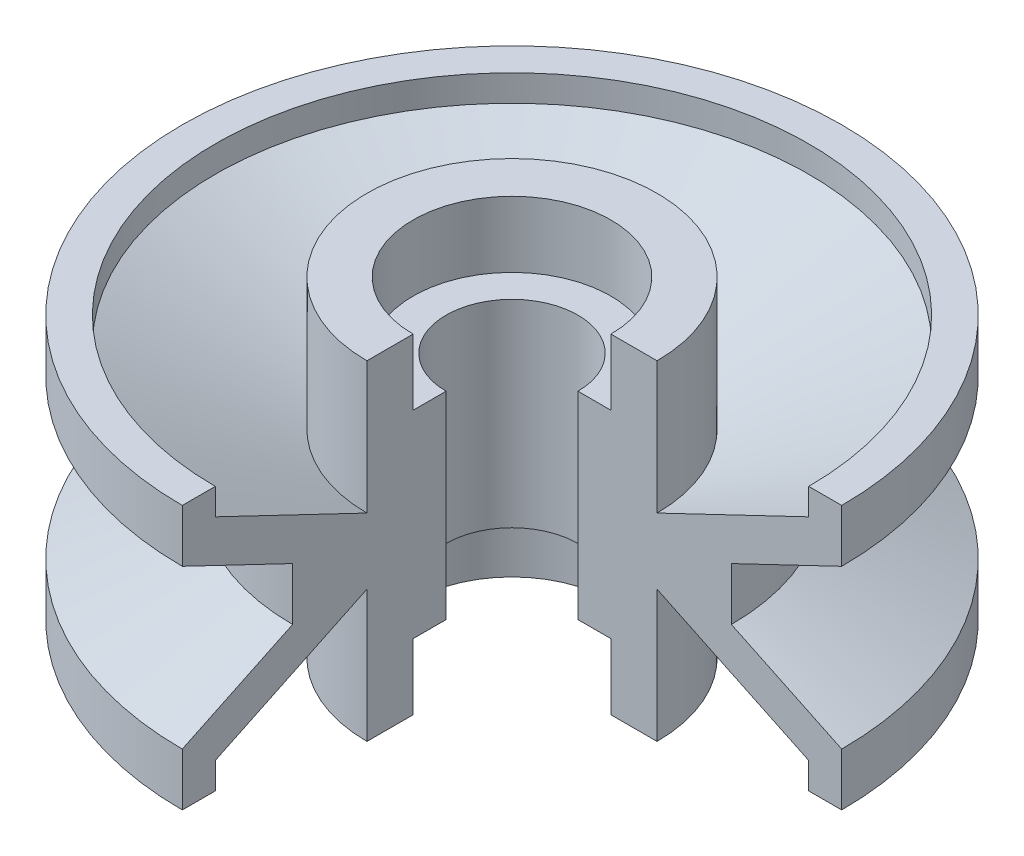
SolidWorks part; units mm, degrees
ref_plane "Front Plane" through (0, 0, 0) normal (0, 0, 1) x (1, 0, 0)
ref_plane "Top Plane" through (0, 0, 0) normal (0, 1, 0) x (1, 0, 0)
ref_plane "Right Plane" through (0, 0, 0) normal (1, 0, 0) x (0, 0, -1)
sketch "Sketch1" plane through (0, 0, 0) normal (0, 0, 1) x (1, 0, 0)
  line L0 (65.5239, 0) -> (0, 0) construction
  line L1 (0, 0) -> (0, 38.113) construction
  line L2 (12.7, -19.05) -> (12.7, 19.05)
  line L3 (12.7, 19.05) -> (19.05, 19.05)
  line L4 (19.05, 19.05) -> (19.05, 31.75)
  line L5 (19.05, 31.75) -> (27.94, 31.75)
  line L6 (27.94, 31.75) -> (27.94, 6.35)
  line L7 (27.94, 6.35) -> (57.15, 20.32)
  line L8 (57.15, 20.32) -> (57.15, 25.4)
  line L9 (57.15, 25.4) -> (63.5, 25.4)
  line L10 (63.5, 25.4) -> (63.5, 15.24)
  line L11 (63.5, 15.24) -> (42.2564, 5.08)
  line L12 (42.2564, 5.08) -> (42.2564, -5.08)
  line L13 (63.5, -15.24) -> (42.2564, -5.08)
  line L14 (63.5, -25.4) -> (63.5, -15.24)
  line L15 (57.15, -25.4) -> (63.5, -25.4)
  line L16 (57.15, -20.32) -> (57.15, -25.4)
  line L17 (27.94, -6.35) -> (57.15, -20.32)
  line L18 (27.94, -31.75) -> (27.94, -6.35)
  line L19 (19.05, -31.75) -> (27.94, -31.75)
  line L20 (19.05, -19.05) -> (19.05, -31.75)
  line L21 (12.7, -19.05) -> (19.05, -19.05)
  point P17 (42.2564, 0)
  point P26 (12.7, 0)
  dimension "D1" = 38.1
  dimension "D2" = 12.7
  dimension "D3" = 25.4
  dimension "D4" = 10.16
  dimension "D5" = 10.16
  dimension "D6" = 5.08
  dimension "D7" = 50.8
  dimension "D8" = 25.4
  dimension "D9" = 38.1
  dimension "D10" = 55.88
  dimension "D11" = 114.3
  dimension "D12" = 127
revolve "Revolve1" add sketch "Sketch1" angle 270 about L1
